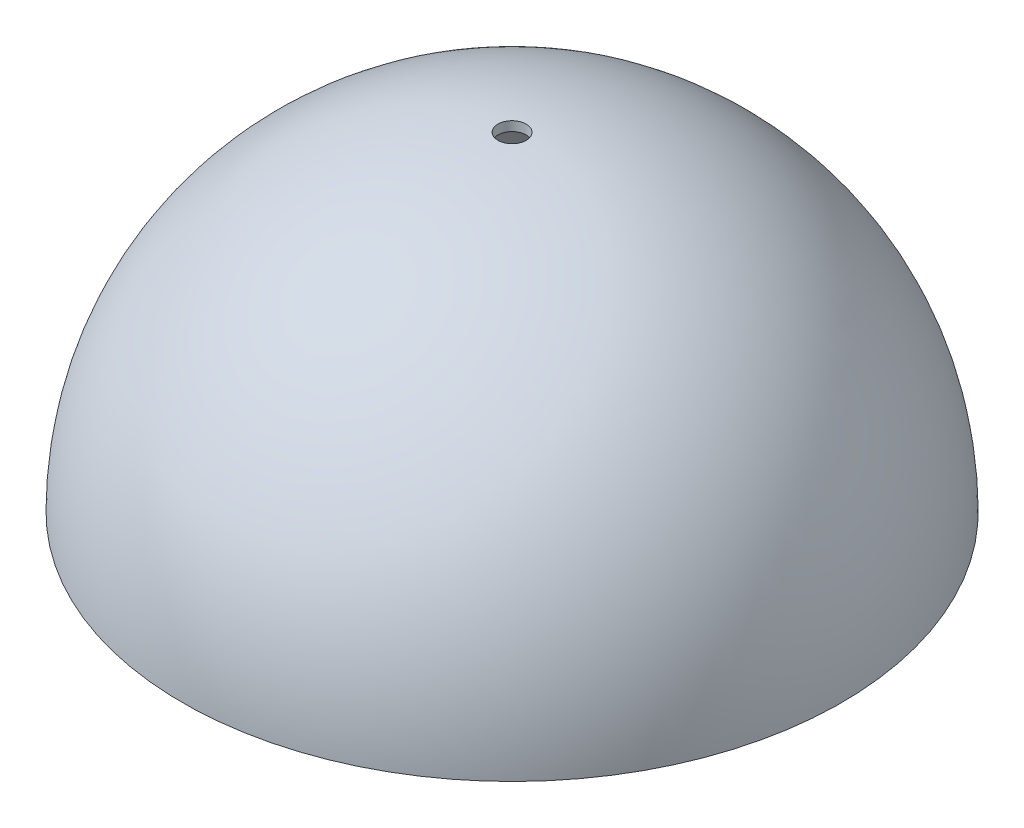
SolidWorks part; units mm, degrees
ref_plane "Face" through (0, 0, 0) normal (0, 0, 1) x (1, 0, 0)
ref_plane "Dessus" through (0, 0, 0) normal (0, 1, 0) x (1, 0, 0)
ref_plane "Droite" through (0, 0, 0) normal (1, 0, 0) x (0, 0, -1)
sketch "Esquisse1" plane through (0, 0, 0) normal (0, 0, 1) x (1, 0, 0)
  line L0 (0, 0) -> (0, 35) construction
  arc A0 (0, 35) -> (35, 0) centre (0, 0) cw
  dimension "D1" = 35
revolve "Révol.-Mince1" add sketch "Esquisse1" angle 360 about L0
sketch "Esquisse2" plane through (0, 0, 0) normal (0, 1, 0) x (1, 0, 0)
  circle A0 centre (0, 0) radius 1.5
  dimension "D1" = 3
extrude "Enlèv. mat.-Extru.2" cut sketch "Esquisse2" along normal through all
